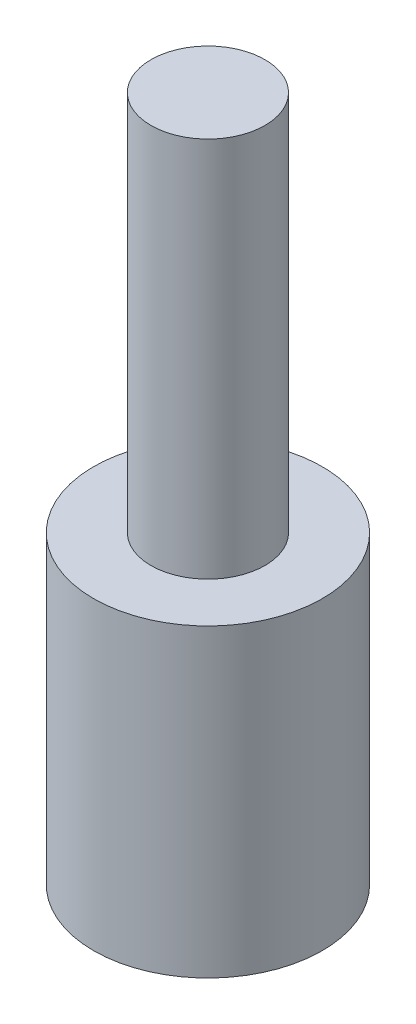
SolidWorks part; units mm, degrees
ref_plane "Front Plane" through (0, 0, 0) normal (0, 0, 1) x (1, 0, 0)
ref_plane "Top Plane" through (0, 0, 0) normal (0, 1, 0) x (1, 0, 0)
ref_plane "Right Plane" through (0, 0, 0) normal (1, 0, 0) x (0, 0, -1)
sketch "Sketch1" plane through (0, 0, 0) normal (0, 1, 0) x (1, 0, 0)
  circle A0 centre (0, 0) radius 4.7625
  dimension "D1" = 9.525
extrude "Boss-Extrude1" add sketch "Sketch1" along normal blind 12.7
sketch "Sketch2" plane through (0, 12.7, 0) normal (0, 1, 0) x (1, 0, 0)
  circle A0 centre (0, 0) radius 2.3749
  dimension "D1" = 4.7498
extrude "Boss-Extrude2" add sketch "Sketch2" along normal blind 15.875
sketch "Sketch3" plane through (0, 0, 0) normal (0, -1, 0) x (1, 0, 0)
  circle A0 centre (0, 0) radius 2.2225
  dimension "D1" = 4.445
extrude "Cut-Extrude1" cut sketch "Sketch3" against normal blind 9.525
